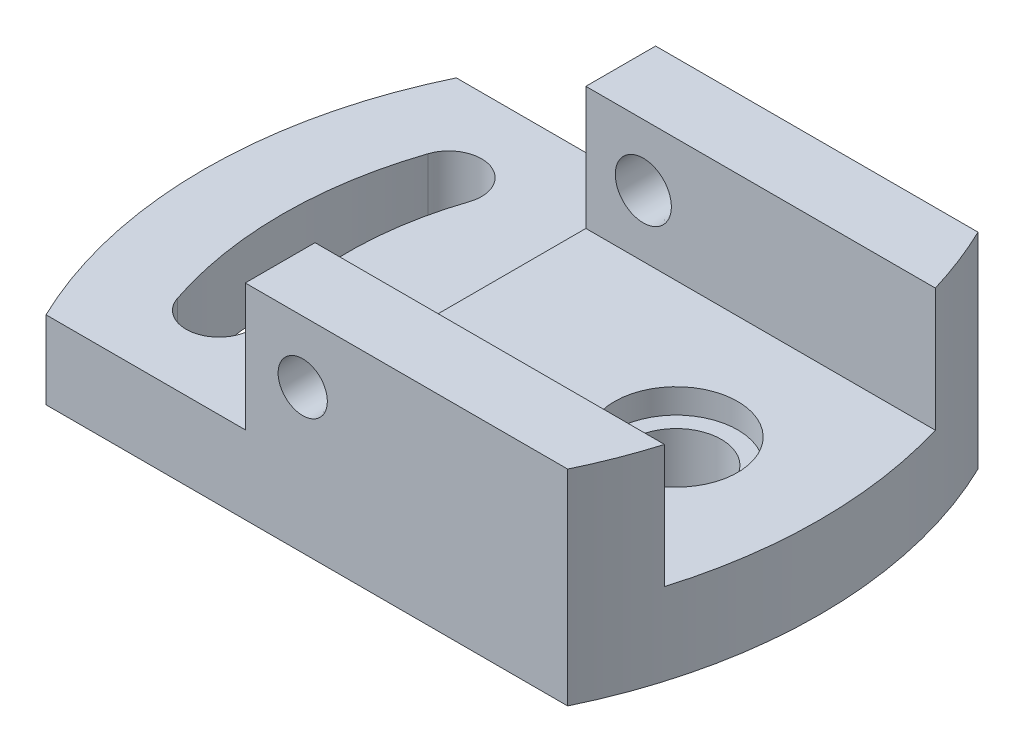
SolidWorks part; units mm, degrees
ref_plane "Front" through (0, 0, 0) normal (0, 0, 1) x (1, 0, 0)
ref_plane "Top" through (0, 0, 0) normal (0, 1, 0) x (1, 0, 0)
ref_plane "Right" through (0, 0, 0) normal (1, 0, 0) x (0, 0, -1)
sketch "Sketch1" plane through (0, 0, 0) normal (0, 1, 0) x (1, 0, 0)
  line L0 (-75, 50) -> (75, -50) construction
  line L1 (-63.5616, 50) -> (63.5616, 50)
  line L2 (-75, 50) -> (-75, -50) construction
  line L3 (-63.5616, -50) -> (63.5616, -50)
  line L4 (75, 50) -> (75, -50) construction
  line L5 (0, 63.024) -> (0, -65.6422) construction
  line L6 (0, -65.6422) -> (0, -69.7565) construction
  line L7 (-63.5616, 50) -> (-75, 50) construction
  line L8 (-63.5616, -50) -> (-75, -50) construction
  line L9 (63.5616, -50) -> (75, -50) construction
  line L10 (63.5616, 50) -> (75, 50) construction
  arc A0 (-63.5616, 50) -> (-63.5616, -50) centre (40, 0) ccw
  arc A1 (63.5616, 50) -> (63.5616, -50) centre (-40, 0) cw
  dimension "D3" = 115
  dimension "D1" = 100
  dimension "D2" = 150
extrude "Extrude1" add sketch "Sketch1" along normal blind 19
sketch "Sketch2" plane through (0, 19, 0) normal (0, 1, 0) x (-1, 0, 0)
  line L0 (-63.5616, -50) -> (63.5616, -50) construction
  line L1 (63.5616, 50) -> (-63.5616, 50) construction
  line L2 (-63.5616, -50) -> (15, -50)
  line L3 (15, 50) -> (-63.5616, 50)
  line L4 (15, 50) -> (15, -50)
  arc A0 (-63.5616, 50) -> (-63.5616, -50) centre (40, 0) ccw construction
  arc A1 (-63.5616, 50) -> (-63.5616, -50) centre (40, 0) ccw
  dimension "D1" = 90
extrude "Extrude2" add sketch "Sketch2" along normal blind 31
sketch "Sketch3" plane through (0, 50, 0) normal (0, 1, 0) x (-1, 0, 0)
  line L0 (0, 0) -> (-93.0388, 0) construction
  line L1 (-70.1635, 33) -> (15, 33)
  line L2 (15, -50) -> (15, 50) construction
  line L3 (-70.1635, -33) -> (15, -33)
  line L4 (15, -33) -> (15, 33)
  arc A0 (-63.5616, 50) -> (-63.5616, -50) centre (40, 0) ccw construction
  arc A3 (-70.1635, 33) -> (-70.1635, -33) centre (40, 0) ccw
  dimension "D1" = 66
extrude "Cut-Extrude1" cut sketch "Sketch3" against normal blind 30
sketch "Sketch5" plane through (0, 0, -50) normal (0, 0, -1) x (-1, 0, 0)
  line L0 (15, 50) -> (15, 19) construction
  line L1 (-63.5616, 50) -> (15, 50) construction
  circle A0 centre (1, 35) radius 7
  point P0 (1, 35)
  dimension "D3" = 14
  dimension "D1" = 14
  dimension "D2" = 15
sketch "Sketch7" plane through (0, 0, 50) normal (0, 0, 1) x (1, 0, 0)
  circle A0 centre (-1, 35) radius 6
  dimension "D1" = 12
loft "Cut-Loft1" cut profiles "Sketch5", "Sketch7"
sketch "Sketch8" plane through (0, 19, 0) normal (0, 1, 0) x (-1, 0, 0)
  arc A0 (43.4266, 28) -> (43.4266, -28) centre (-40, 0) cw construction
  arc A1 (63.5616, -50) -> (63.5616, 50) centre (-40, 0) ccw construction
  arc A2 (35.8424, -25.4545) -> (51.0109, -30.5455) centre (43.4266, -28) ccw
  arc A3 (35.8424, 25.4545) -> (51.0109, 30.5455) centre (43.4266, 28) cw
  arc A4 (35.8424, -25.4545) -> (35.8424, 25.4545) centre (-40, 0) ccw
  arc A5 (51.0109, -30.5455) -> (51.0109, 30.5455) centre (-40, 0) ccw
  dimension "D1" = 88
  dimension "D3" = 8
  dimension "D2" = 56
extrude "Cut-Extrude2" cut sketch "Sketch8" against normal through all
sketch "Sketch9" plane through (0, 0, 0) normal (0, 0, 1) x (1, 0, 0)
  line L0 (40, 36.1662) -> (40, -10.1279) construction
  line L1 (40, 20) -> (55, 20)
  line L2 (-15, 20) -> (70.1635, 20) construction
  line L3 (55, 20) -> (55, 14)
  line L4 (55, 14) -> (51, 14)
  line L5 (51, 14) -> (51, 0)
  line L6 (-63.5616, 0) -> (63.5616, 0) construction
  line L7 (51, 0) -> (40, 0)
  line L8 (40, 0) -> (40, 20)
  line L9 (-75, 19) -> (-75, 0) construction
  dimension "D1" = 115
  dimension "D2" = 30
  dimension "D3" = 22
  dimension "D4" = 6
revolve "Cut-Revolve1" cut sketch "Sketch9" angle 360 about L0
